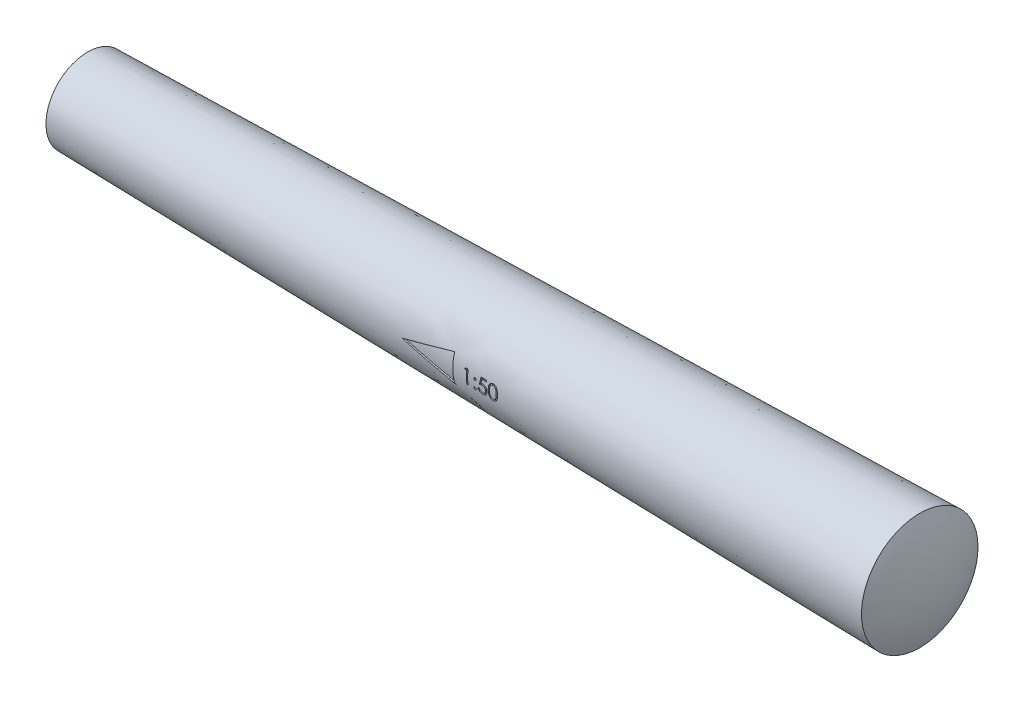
SolidWorks part; units mm, degrees
ref_plane "Front Plane" through (0, 0, 0) normal (0, 0, 1) x (1, 0, 0)
ref_plane "Top Plane" through (0, 0, 0) normal (0, 1, 0) x (1, 0, 0)
ref_plane "Right Plane" through (0, 0, 0) normal (1, 0, 0) x (0, 0, -1)
sketch "Sketch1" plane through (0, 0, 0) normal (1, 0, 0) x (0, 0, -1)
  circle A0 centre (0, 0) radius 3
  dimension "D1" = 6
extrude "Extrude1" add sketch "Sketch1" along normal mid plane 60
draft "Draft1" type of draft neutral plane draft angle 1.146 faces to draft 1 parameters "D1"=1.146
sketch "Sketch2" plane through (0, 0, 0) normal (0, 0, 1) x (1, 0, 0)
  line L0 (-30, 0) -> (-30, 3)
  line L1 (-30, 3) -> (-30, -3) construction
  line L2 (-30, 0) -> (-30.9, 0)
  line L3 (-30.9, 0) -> (-30.9, -3.6) construction
  line L4 (30, 0) -> (30, 4.2)
  line L5 (30, -4.2) -> (30, 4.2) construction
  line L6 (30, 0) -> (30.9, 0)
  line L7 (30.9, 0) -> (30.9, -3.6) construction
  line L8 (-30, -3) -> (30, -4.2) construction
  arc A0 (-30.9, 0) -> (-30, 3) centre (-25.45, 0) cw
  arc A1 (30.9, 0) -> (30, 4.2) centre (20.6498, 0) ccw
  point P14 (0, -3.6)
revolve "Revolve1" add sketch "Sketch2" angle 360 about L2
sketch "Sketch5" plane through (0, 0, 0) normal (0, 0, 1) x (1, 0, 0)
  line L0 (0, 3.6) -> (0, -3.6) construction
  line L1 (30, 4.2) -> (-30, 3) construction
  line L2 (-30, -3) -> (30, -4.2) construction
ref_plane "Plane2" through (0, 0, 0) normal (-0.02, 0, 0.9998) x (0.9998, 0, 0.02)
sketch "Sketch6" plane through (0, 0, 0) normal (-0.02, 0, 0.9998) x (0.9998, 0, 0.02)
  line L0 (0, 0) -> (0, 1)
  line L1 (0, 3.6) -> (0, -3.6) construction
  line L2 (0, 1) -> (-3.7321, 0)
  line L3 (-3.7321, 0) -> (0, -1)
  line L4 (0, -1) -> (0, 0)
  line L5 (0, -0.5) -> (4, -0.5) construction
  text T0 "1:50" font "Century Gothic" height 1
  dimension "D1" = 2
  dimension "D2" = 30
  dimension "D3" = 4
wrap "Wrap2" sketch "Sketch6" wrap type deboss source sketch "Sketch6" thickness 0.1 parameters "D1"=0.1
equation "\"D2@Sketch2\" = \"D1@Sketch2\""
